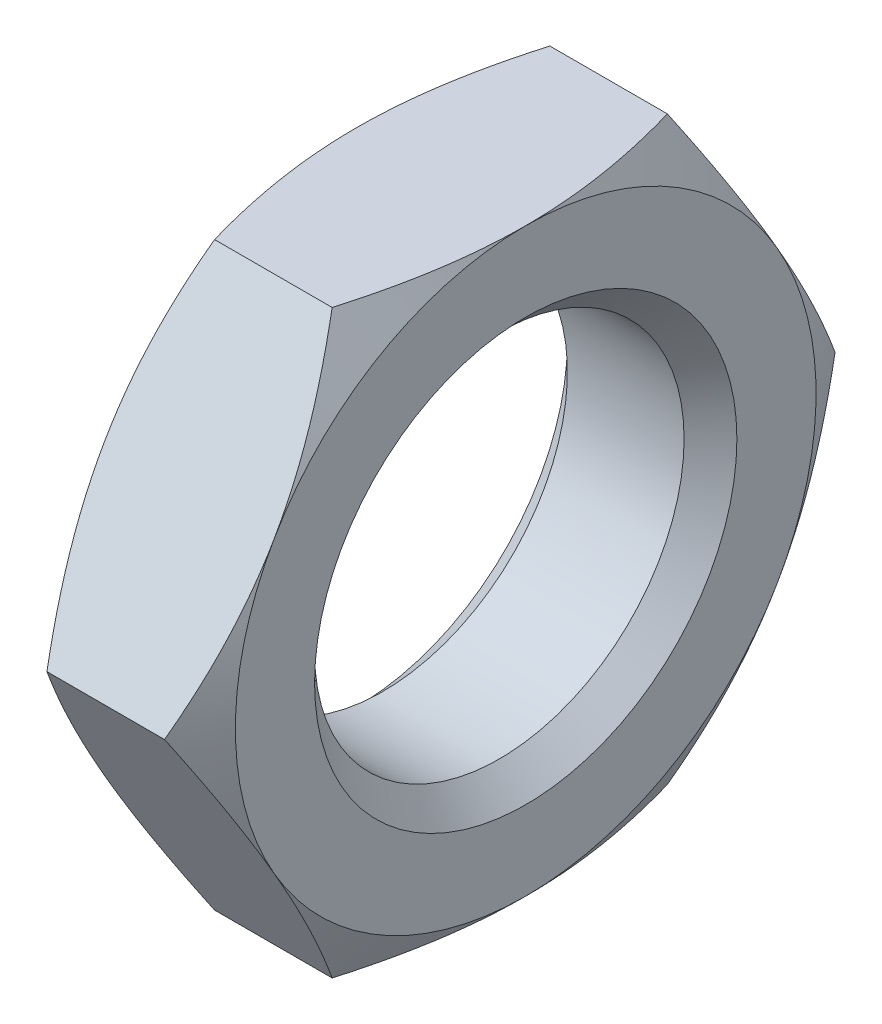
SolidWorks part; units mm, degrees
ref_plane "Front Plane" through (0, 0, 0) normal (0, 0, 1) x (1, 0, 0)
ref_plane "Top Plane" through (0, 0, 0) normal (0, 1, 0) x (1, 0, 0)
ref_plane "Right Plane" through (0, 0, 0) normal (1, 0, 0) x (0, 0, -1)
sketch "Sketch1" plane through (0, 0, 0) normal (1, 0, 0) x (0, 0, -1)
  line L1 (6.3509, 11) -> (-6.3509, 11)
  line L2 (-6.3509, 11) -> (-12.7017, 0)
  line L3 (-12.7017, 0) -> (-6.3509, -11)
  line L4 (-6.3509, -11) -> (6.3509, -11)
  line L5 (6.3509, -11) -> (12.7017, 0)
  line L6 (12.7017, 0) -> (6.3509, 11)
  circle A0 centre (0, 0) radius 11 construction
  circle A1 centre (0, 0) radius 7
extrude "Extrude1" add sketch "Sketch1" along normal blind 6.42
sketch "Sketch2" plane through (0, 0, 0) normal (0, 0, 1) x (1, 0, 0)
  line L0 (6.42, 11) -> (6.42, 44)
  line L1 (6.42, 44) -> (0, 44)
  line L2 (0, 44) -> (0, 11)
  line L3 (0, 11) -> (3.21, 16.5599)
  line L4 (3.21, 16.5599) -> (6.42, 11)
revolve "Cut-Revolve1" cut sketch "Sketch2" angle 360 about axis through (6.42, 0, 0) along (-1, 0, 0)
chamfer "Chamfer1" distance 1 angle 45 2 edges at (0, 0, -7) (6.42, 0, -7)
equation "\"D2@Sketch2\"=\"D1@Sketch1\"*2"
